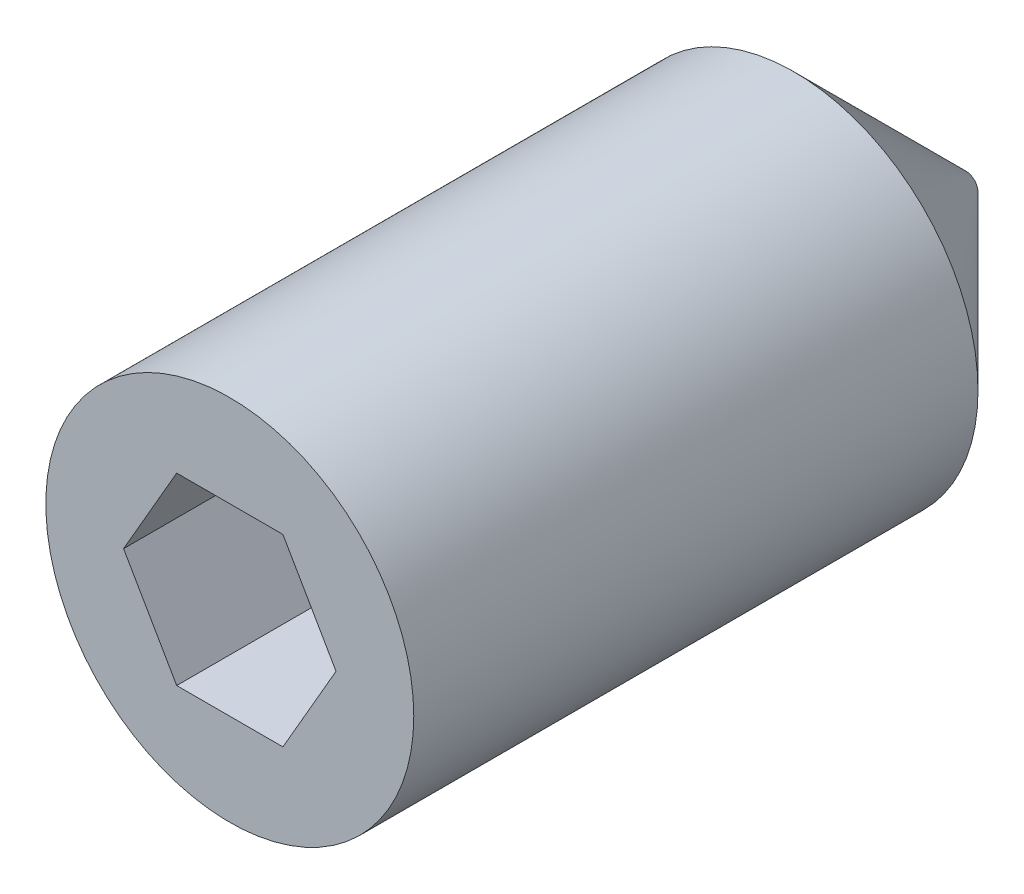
SolidWorks part; units mm, degrees
ref_plane "Front Plane" through (0, 0, 0) normal (0, 0, 1) x (1, 0, 0)
ref_plane "Top Plane" through (0, 0, 0) normal (0, 1, 0) x (1, 0, 0)
ref_plane "Right Plane" through (0, 0, 0) normal (1, 0, 0) x (0, 0, -1)
sketch "Sketch1" plane through (0, 0, 0) normal (0, 0, 1) x (1, 0, 0)
  circle A0 centre (0, 0) radius 1.5
  dimension "D1" = 3
extrude "Boss-Extrude1" add sketch "Sketch1" against normal blind 6
sketch "Sketch2" plane through (0, 0, 0) normal (0, 0, 1) x (1, 0, 0)
  line L1 (0.866, 0) -> (0.433, 0.75)
  line L2 (0.433, 0.75) -> (-0.433, 0.75)
  line L3 (-0.433, 0.75) -> (-0.866, 0)
  line L4 (-0.866, 0) -> (-0.433, -0.75)
  line L5 (-0.433, -0.75) -> (0.433, -0.75)
  line L6 (0.433, -0.75) -> (0.866, 0)
  circle A0 centre (0, 0) radius 0.75 construction
  dimension "D1" = 1.5
extrude "Cut-Extrude1" cut sketch "Sketch2" against normal blind 1.2
sketch3d "3DSketch1"
  line L0 (0, 0, 0) -> (0, 0, -6) construction
sketch "Sketch3" plane through (0, 0, 0) normal (1, 0, 0) x (0, 0, -1)
  line L0 (6, 1.5) -> (6, -1.5)
  line L1 (6, 1.5) -> (6, 0.1)
  line L2 (0, 0) -> (6, 0) construction
  line L3 (6, 0.1) -> (4.6, 1.5)
  line L5 (6, 1.5) -> (0, 1.5)
  line L6 (0, -0.8) -> (6, -1.5)
  line L8 (6, 1.5) -> (4.6, 1.5)
  dimension "D1" = 0.1
  dimension "D3" = 45
revolve "Chamfer" cut sketch "Sketch3" angle 360 about L0
sketch "Sketch4" plane through (0, 0, 0) normal (1, 0, 0) x (0, 0, -1)
  line L0 (6, 0.1) -> (6, -0.1)
  line L1 (6, 0.1) -> (6, 0)
  line L2 (6, 0) -> (5.9636, 0)
  line L3 (5.9636, 0) -> (6, 0.1)
  dimension "D1" = 20
revolve "Hollow" [suppressed] cut sketch "Sketch4" angle 360 about L2
sketch "Sketch5" plane through (0, 0, 0) normal (1, 0, 0) x (0, 0, -1)
  line L0 (0, 0) -> (6, 0) construction
  line L1 (4.6, 0) -> (6, 0) construction
  line L2 (4.6, 1.5) -> (4.6, 0) construction
  line L3 (6, 0.1) -> (6, -0.1)
  line L4 (6, 0) -> (6, -0.1) construction
  line L5 (4.6, 1.5) -> (6.25, 1.5)
  line L6 (6.25, 1.5) -> (6.25, 0)
  line L7 (6.25, 0) -> (6, 0)
  line L9 (4.6, 1.5) -> (0, 1.5)
  line L13 (0, -0.8) -> (1.8, -0.8)
  line L15 (-1, 1.5) -> (0, 1.5) construction
  arc A0 (4.6, 1.5) -> (6, 0) centre (4.4964, 0) cw
  dimension "D1" = 0.25
  dimension "D2" = 1
revolve "Domed" [suppressed] cut sketch "Sketch5" angle 360 about L7
sketch "Sketch6" plane through (0, 0, 0) normal (1, 0, 0) x (0, 0, -1)
  line L0 (6, 0.1) -> (6, -0.1)
  line L1 (6, 0.1) -> (6, 0) construction
  line L3 (4.6, 1.5) -> (4.1, 1.5)
  line L6 (4.6, 1.5) -> (0, 1.5)
  line L7 (6, 0.1) -> (4.6, 1.5)
  line L8 (4.6, 1.5) -> (0, 1.5) construction
  line L9 (4.1, 1.5) -> (5.5, 0.1)
  line L10 (5.5, 0.1) -> (6, 0.1)
  line L11 (0, -0.8) -> (1.8, -0.8)
  line L12 (0, 1.5) -> (0, -1.5) construction
  line L13 (0, 1.5) -> (-1, 1.5) construction
  dimension "D1" = 0.5
  dimension "D2" = 1
revolve "Dog" [suppressed] cut sketch "Sketch6" angle 360
